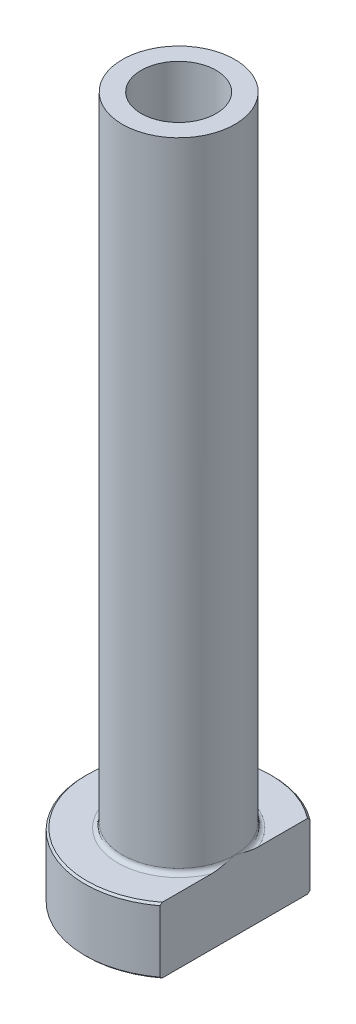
SolidWorks part; units mm, degrees
ref_plane "Front Plane" through (0, 0, 0) normal (0, 0, 1) x (1, 0, 0)
ref_plane "Top Plane" through (0, 0, 0) normal (0, 1, 0) x (1, 0, 0)
ref_plane "Right Plane" through (0, 0, 0) normal (1, 0, 0) x (0, 0, -1)
sketch "Sketch1" plane through (0, 0, 0) normal (0, 0, 1) x (1, 0, 0)
  line L0 (-4, 75) -> (-6, 75)
  line L1 (-6, 75) -> (-6, 7)
  line L2 (-6, 7) -> (-10, 7)
  line L3 (-10, 7) -> (-10, 0)
  line L4 (8.8, 0) -> (-8.8, 0) construction
  line L5 (-10, 0) -> (-4.25, 0)
  line L6 (-4, 30) -> (-4, 75)
  line L7 (0, 92.1877) -> (0, -15.5353) construction
  line L8 (0, -11) -> (0, 11) construction
  line L9 (-4, 30) -> (-4.25, 18)
  line L10 (-4.25, 18) -> (-4.25, 0)
  dimension "D1" = 0.25
  dimension "ID" = 8
  dimension "OD" = 12
  dimension "L" = 75
  dimension "H" = 20
  dimension "T" = 7
  dimension "N" = 45
  dimension "D2" = 12
  dimension "L-N" = 30
revolve "Revolve1" add sketch "Sketch1" angle 360 about L7
fillet "Fillet1" radius 0.5 1 edges at (0, 7, 6)
chamfer "Chamfer1" distance 0.2 angle 45 2 edges at (0, 7, 10) (0, 0, 10)
sketch "Sketch2" plane through (0, 0, 0) normal (0, -1, 0) x (1, 0, 0)
  line L0 (6, 8) -> (6, -8)
  circle A0 centre (0, 0) radius 10 construction
  arc A1 (6, 8) -> (6, -8) centre (0, 0) cw
  circle A2 centre (0, 0) radius 6 construction
extrude "Cut-Extrude1" cut sketch "Sketch2" against normal through all
chamfer "Chamfer2" distance 0.5 angle 45 1 edges at (0, 0, 4.25)
